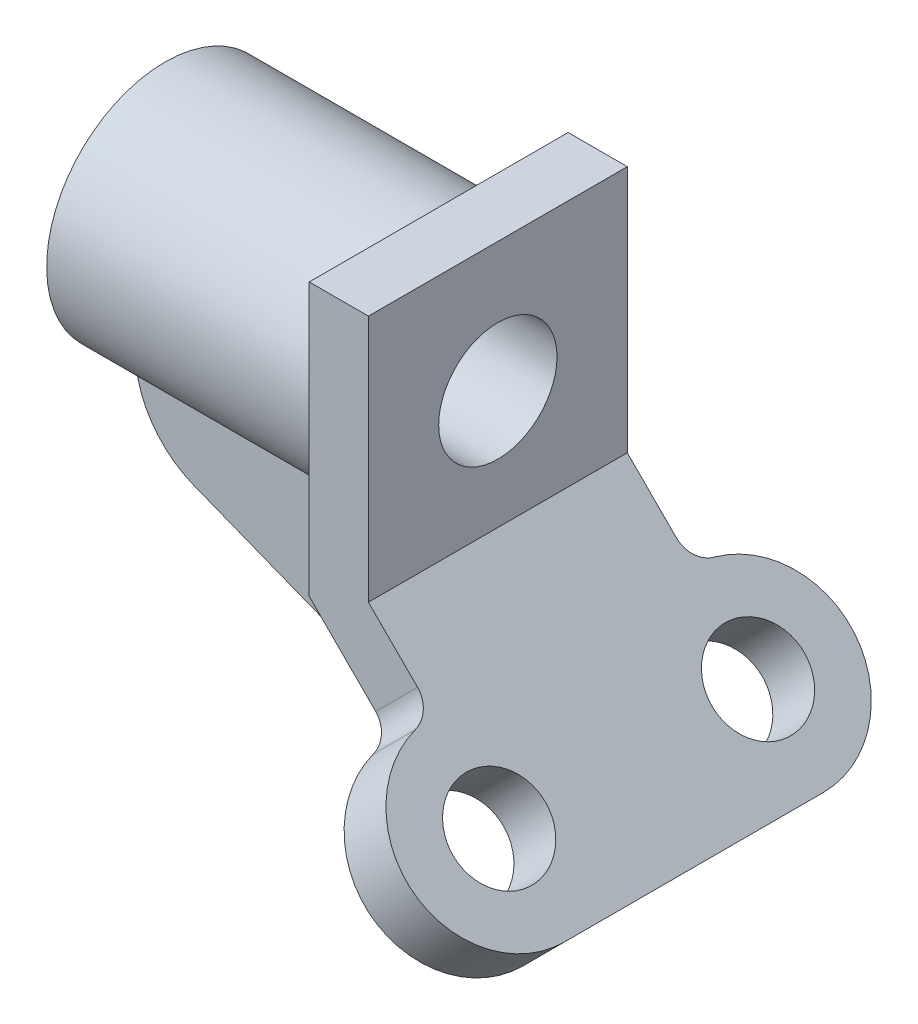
SolidWorks part; units mm, degrees
ref_plane "Front" through (0, 0, 0) normal (0, 0, 1) x (1, 0, 0)
ref_plane "Top" through (0, 0, 0) normal (0, 1, 0) x (1, 0, 0)
ref_plane "Right" through (0, 0, 0) normal (1, 0, 0) x (0, 0, -1)
sketch "Sketch1" plane through (0, 0, 0) normal (0, 0, 1) x (1, 0, 0)
  line L0 (0, 0) -> (0, 67)
  line L1 (0, 0) -> (53.033, -53.033)
  line L2 (0, 0) -> (0, -37.9894) construction
  point P5 (0, 32)
  point P6 (35.3553, -35.3553)
  dimension "D1" = 45
  dimension "D2" = 67
  dimension "D3" = 75
  dimension "D4" = 35
  dimension "D5" = 25
extrude "Base-Extrude-Thin" add sketch "Sketch1" along normal mid plane 70 thin
sketch "Sketch3" plane through (0, 0, 0) normal (0.7071, 0.7071, 0) x (-0.7071, 0.7071, 0)
  line L0 (0, 35) -> (-75, 35) construction
  line L1 (-75, 35) -> (-75, -35) construction
  circle A0 centre (-50, 35) radius 25
  dimension "D1" = 50
extrude "Boss-Extrude1" add sketch "Sketch3" against normal up to surface (16 mm away)
sketch "Sketch7" plane through (0, 0, 0) normal (0.7071, 0.7071, 0) x (-0.7071, 0.7071, 0)
  circle A0 centre (-50, 35) radius 12.5
  dimension "D1" = 25
extrude "Cut-Extrude1" cut sketch "Sketch7" against normal through all
mirror "Mirror2" about plane through (0, 0, 0) normal (0, 0, 1) of "Cut-Extrude1", "Boss-Extrude1"
sketch "Sketch4" plane through (0, 0, 0) normal (1, 0, 0) x (0, 0, -1)
  circle A0 centre (0, 32) radius 32
  dimension "D1" = 64
extrude "Boss-Extrude2" add sketch "Sketch4" against normal blind 90
sketch "Sketch5"
  line L0 (-90, 64) -> (-90, 0) construction
  line L1 (-74.1556, -23.2632) -> (34.206, -65.9107)
  line L2 (-90, 0) -> (-16, 0) construction
  line L3 (53.033, -53.033) -> (41.7193, -64.3467) construction
  line L4 (-90, 0) -> (-16, 0) construction
  line L6 (-16, 67) -> (-16, -6.6274) construction
  line L7 (-16, -6.6274) -> (6.364, -28.9914) construction
  line L8 (-16, -6.6274) -> (41.7193, -64.3467)
  line L9 (-16, 32) -> (-16, -6.6274)
  line L10 (-90, 32) -> (-90, 0)
  line L11 (-16, 32) -> (-90, 32)
  arc A0 (-90, 0) -> (-74.1556, -23.2632) centre (-65, 0) ccw
  arc A1 (34.206, -65.9107) -> (41.7193, -64.3467) centre (36.7696, -59.397) ccw
fillet "Fillet1" radius 7 2 edges at (12.0208, -23.3345, 35) (12.0208, -23.3345, -35)
extrude "Boss-Extrude5" add sketch "Sketch5" along normal mid plane 16
sketch "Sketch9" plane through (-90, 0, 0) normal (-1, 0, 0) x (0, 0, 1)
  circle A0 centre (0, 32) radius 16
  dimension "D1" = 32
extrude "Cut-Extrude2" cut sketch "Sketch9" against normal through all
